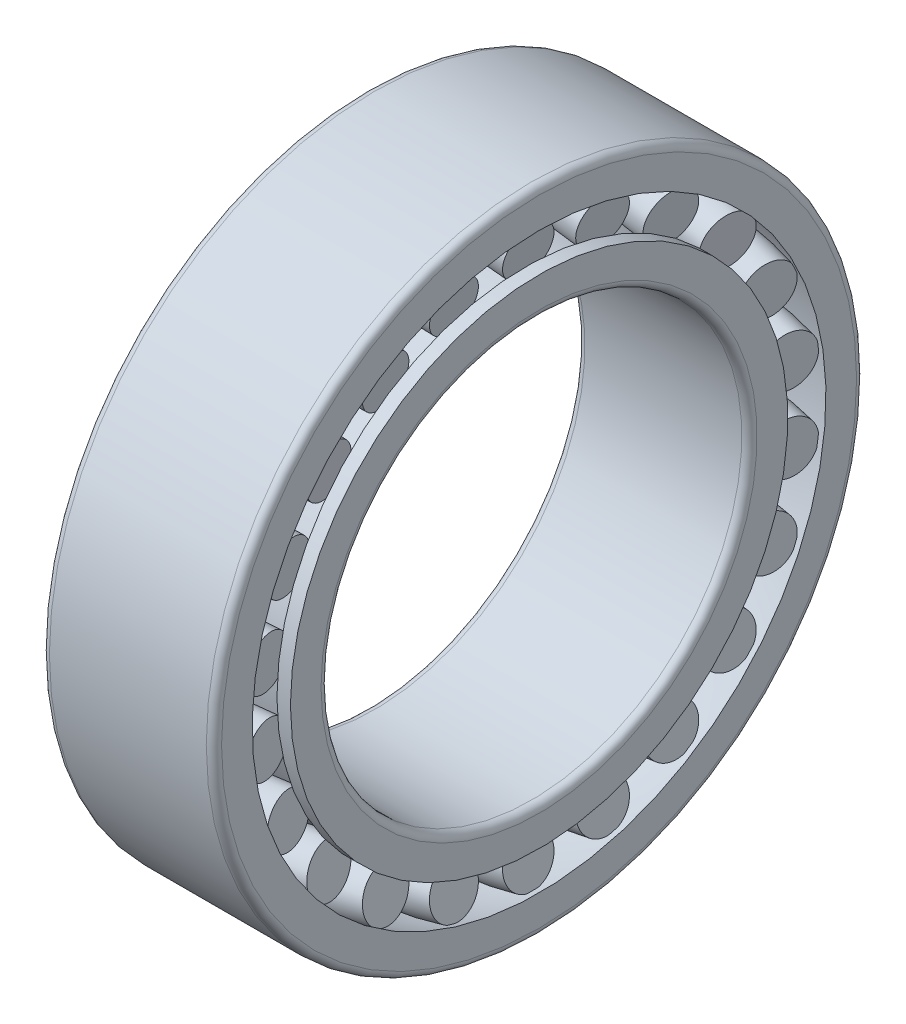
SolidWorks part; units mm, degrees
ref_plane "Front" through (0, 0, 0) normal (0, 0, 1) x (1, 0, 0)
ref_plane "Top" through (0, 0, 0) normal (0, 1, 0) x (1, 0, 0)
ref_plane "Right" through (0, 0, 0) normal (1, 0, 0) x (0, 0, -1)
sketch "Sketch1" plane through (0, 0, 0) normal (0, 0, 1) x (1, 0, 0)
  line L0 (-22.5, 0) -> (22.5, 0) construction
  line L1 (22.5, 75) -> (22.5, 85)
  line L2 (-3.75, 65) -> (3.75, 65)
  line L3 (-22.5, 55) -> (22.5, 55)
  line L4 (-22.5, 55) -> (-22.5, 62.211)
  line L5 (-22.5, 85) -> (22.5, 85)
  line L6 (22.5, 55) -> (22.5, 62.211)
  line L7 (0, 0) -> (0, 140) construction
  line L8 (-22.5, 75) -> (-22.5, 85)
  line L9 (-3.75, 65) -> (-6.0349, 78.0694)
  line L10 (-20.8108, 75.4862) -> (-18.5259, 62.4168)
  line L11 (3.75, 65) -> (6.0349, 78.0694)
  line L12 (20.8108, 75.4862) -> (18.5259, 62.4168)
  line L13 (6.0349, 70) -> (22.5, 70)
  line L14 (-18.9775, 65) -> (-22.5, 65)
  line L15 (-19.6683, 68.9515) -> (-4.8924, 71.5347)
  line L16 (-22.48, 75.0269) -> (-22.48, 84.98)
  line L17 (-22.48, 84.98) -> (22.48, 84.98)
  line L18 (22.48, 75.0269) -> (22.48, 84.98)
  line L19 (-22.48, 55.02) -> (-22.48, 62.1915)
  line L20 (-22.48, 55.02) -> (22.48, 55.02)
  line L21 (22.48, 55.02) -> (22.48, 62.1915)
  arc A0 (22.5, 75) -> (-22.5, 75) centre (0, 0) ccw
  arc A1 (-3.75, 65) -> (-22.5, 62.211) centre (-24.5608, 140.4862) cw
  arc A2 (3.75, 65) -> (22.5, 62.211) centre (24.5608, 140.4862) ccw
  arc A3 (22.48, 75.0269) -> (-22.48, 75.0269) centre (0, 0) ccw
  arc A4 (-3.7447, 64.9807) -> (-22.48, 62.1915) centre (-24.5608, 140.4862) cw
  arc A5 (3.7447, 64.9807) -> (22.48, 62.1915) centre (24.5608, 140.4862) ccw
  point P16 (0, 85)
  dimension "D1" = 3.5225
  dimension "D2" = 0.02
  dimension "XD" = 110
  dimension "D3" = 0.02
  dimension "DD" = 170
  dimension "D4" = 140
  dimension "DB" = 45
  dimension "XD1" = 130
  dimension "GZJJ" = 7.5
  dimension "DD1" = 150
  dimension "GZK" = 15
  dimension "zj" = 140
revolve "Revolve1" add sketch "Sketch1" angle 360 about L0
sketch "Sketch2" plane through (0, 0, 0) normal (0, 0, 1) x (1, 0, 0)
  line L0 (-3.75, 65) -> (-6.0349, 78.0694) construction
  line L1 (-19.6683, 68.9515) -> (-4.8924, 71.5347) construction
  line L2 (-20.8108, 75.4862) -> (-18.5259, 62.4168) construction
  line L3 (-4.8924, 71.5347) -> (-6.0349, 78.0694)
  line L4 (-19.6683, 68.9515) -> (-4.8924, 71.5347)
  line L5 (-20.8108, 75.4862) -> (-19.6683, 68.9515)
  line L6 (-19.6683, 68.9515) -> (-1.7006, 72.0927) construction
  arc A0 (22.5, 75) -> (-22.5, 75) centre (0, 0) ccw construction
  arc A1 (-6.0349, 78.0694) -> (-20.8108, 75.4862) centre (0, 0) ccw
revolve "Revolve2" add sketch "Sketch2" angle 360 about L6
sketch "Sketch3" plane through (0, 0, 0) normal (0, 0, 1) x (1, 0, 0)
  line L0 (-22.5, 75) -> (-22.5, 85) construction
  line L1 (22.5, 75) -> (22.5, 85) construction
  line L2 (-22.5, 85) -> (22.5, 85) construction
  line L3 (-22.5, 75) -> (-22.5, 85)
  line L4 (22.5, 75) -> (22.5, 85)
  line L5 (-22.5, 85) -> (22.5, 85)
  arc A0 (22.5, 75) -> (-22.5, 75) centre (0, 0) ccw construction
  arc A1 (22.5, 75) -> (-22.5, 75) centre (0, 0) ccw
revolve "Revolve3" add sketch "Sketch3" angle 360 about axis through (-22.5, 0, 0) along (1, 0, 0)
mirror "Mirror1" about plane through (0, 0, 0) normal (1, 0, 0)
pattern_circular "Circular-Pattern1" count 22 over 360 about axis through (0, 0, 0) along (1, 0, 0)
fillet "Fillet1" radius 2 2 edges at (-22.5, 0, 85) (22.5, 0, 85)
fillet "Fillet2" radius 2 2 edges at (22.5, 0, 55) (-22.5, 0, 55)
sketch "Sketch4" plane through (0, 0, 0) normal (0, 0, 1) x (1, 0, 0)
  line L0 (-20.8108, 75.4862) -> (-18.5259, 62.4168) construction
  line L1 (-18.9775, 65) -> (-22.5, 65) construction
  line L2 (-18.9775, 65) -> (-18.5259, 62.4168)
  line L3 (-18.9775, 65) -> (-22.5, 65)
  line L4 (-22.5, 65) -> (-22.5, 62.211)
  arc A0 (-22.5, 62.211) -> (-3.75, 65) centre (-24.5608, 140.4862) ccw construction
  arc A1 (-22.5, 62.211) -> (-18.5259, 62.4168) centre (-24.5608, 140.4862) ccw
revolve "Revolve4" add sketch "Sketch4" angle 360 about axis through (-22.5, 0, 0) along (1, 0, 0)
mirror "Mirror2" about plane through (0, 0, 0) normal (1, 0, 0) of "Revolve4"
equation "\"D1@Fillet2\"=\"D1@Fillet1\""
equation "\"XD1@Sketch1\" =  ( 2 * \"XD@Sketch1\" + \"DD@Sketch1\" )  /3"
equation "\"DD1@Sketch1\" =  ( 2 * \"DD@Sketch1\" + \"XD@Sketch1\" )  / 3"
equation "\"GZJJ@Sketch1\" = \"DB@Sketch1\" / 6"
equation "\"GZK@Sketch1\" = \"DB@Sketch1\" / 3"
equation "\"zj@Sketch1\" = (  \"DD@Sketch1\" + \"XD@Sketch1\" )  / 2"
equation "\"D1@Circular-Pattern1\" = int( 3.14159265 / atn(( \"GZK@Sketch1\" / 2) / sqr( \"XD@Sketch1\" * \"XD@Sketch1\"/4 - ( \"GZK@Sketch1\" / 2) *  ( \"GZK@Sketch1\" / 2))))"
equation "\"D1@Sketch1\" = \"XD1@Sketch1\" + 0.002"
